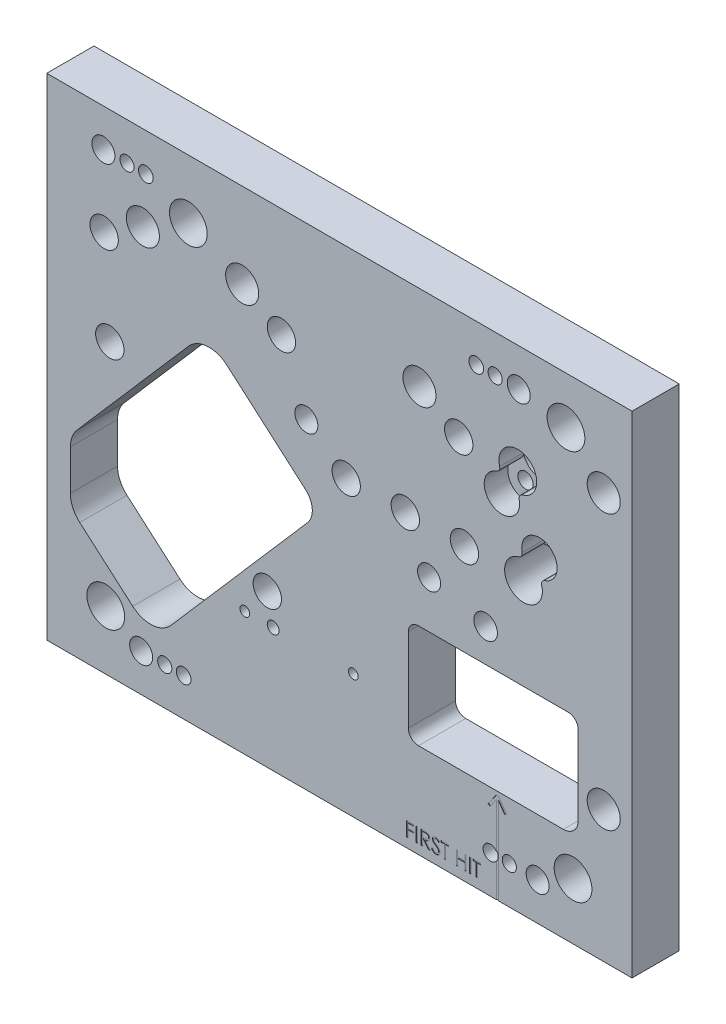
SolidWorks part; units mm, degrees
extrude "Boss-Extrude1" add sketch "Sketch1" along normal blind 31.75 separate body
sketch "Sketch1" plane through (0, 0, 0) normal (0, 0, 1) x (1, 0, 0)
  line L0 (0, 0) -> (-400.0068, 0) construction
  line L1 (-57.15, 149.225) -> (-450.85, 149.225)
  line L2 (-57.15, 149.225) -> (-57.15, -180.975)
  line L3 (-57.15, -180.975) -> (-450.85, -180.975)
  line L4 (-450.85, 149.225) -> (-450.85, -180.975)
  line L6 (0, -304.8) -> (0, 304.8) construction
  line L10 (-101.6, 85.471) -> (-141.351, 85.471) construction
  line L11 (-1219.2, -304.8) -> (0, -304.8) construction
  line L12 (0, 304.8) -> (-1219.2, 304.8) construction
  line L14 (-159.131, -81.407) -> (-149.6352, -81.407) construction
  line L15 (-141.351, -85.471) -> (-141.351, 85.471) construction
  line L16 (0, -304.8) -> (0, 304.8) construction
  line L17 (-101.6, -85.471) -> (-141.351, -85.471) construction
  line L18 (-125.476, -104.521) -> (-149.606, -104.521) construction
  dimension "D1" = 149.225
  dimension "D2" = 330.2
  dimension "D3" = 180.975
  dimension "D4" = 63.754
  dimension "D5" = 99.568
  dimension "D6" = 84.201
  dimension "D7" = 57.15
  dimension "D8" = 393.7
  dimension "D9" = 123.825
  dimension "D10" = 155.575
  dimension "D11" = 57.15
  dimension "D12" = 95.504
  dimension "D13" = 76.454
ref_plane "Front" through (0, 0, 0) normal (0, 0, 1) x (1, 0, 0)
ref_plane "Top" through (0, 0, 0) normal (0, 1, 0) x (1, 0, 0)
ref_plane "Right" through (0, 0, 0) normal (1, 0, 0) x (0, 0, -1)
hole_wizard "Hole1" positions "Point_Sketch" profile "Profil_Sketch" hole size "Ø0.15" standard "ISO"
sketch "Point_Sketch" plane through (-35.4043, 98.1359, 31.75) normal (0, 0, -1) x (1, 0, 0)
  point P0 (-40.7957, 6.0609)
  point P2 (-40.7957, 190.4649)
  point P4 (-164.7477, 6.0609)
  point P6 (-284.0007, 6.0609)
  point P8 (-350.8027, 6.0609)
sketch "Profil_Sketch" plane through (-76.2, 92.075, 31.75) normal (1, 0, 0) x (0, -1, 0)
  line L0 (0, 0) -> (0, 31.75)
  line L1 (0, 31.75) -> (11.1252, 31.75)
  line L2 (11.1252, 31.75) -> (11.1252, 0)
  line L5 (11.1252, 0) -> (0, 0)
  line L11 (0, -6.35) -> (0, 107.95) construction
  dimension "Diameter" = 22.2504
  dimension "Thru Hole Depth" = 31.75
other "usin_DL090<1>"
sketch "Sketch4-P250520R_102_Die Yoke-1 Insert-1" plane through (0, 0, 31.75) normal (0, 0, 1) x (1, 0, 0)
  line L90 (-275.9499, -25.4471) -> (-366.7171, -129.9659) construction
  line L91 (-393.5913, -131.8583) -> (-428.4159, -101.6157) construction
  line L92 (-434.975, -87.2323) -> (-434.975, -60.7311) construction
  line L93 (-355.9919, 37.3355) -> (-430.3083, -48.2402) construction
  line L94 (-277.3377, -5.7393) -> (-329.1177, 39.2279) construction
  line L95 (-275.9499, -25.4471) -> (-366.7171, -129.9659)
  line L96 (-393.5913, -131.8583) -> (-428.4159, -101.6157)
  line L97 (-434.975, -87.2323) -> (-434.975, -60.7311)
  line L98 (-355.9919, 37.3355) -> (-430.3083, -48.2402)
  line L99 (-277.3377, -5.7393) -> (-329.1177, 39.2279)
  arc A82 (-275.9499, -25.4471) -> (-277.3377, -5.7393) centre (-286.4977, -16.2871) ccw construction
  arc A87 (-393.5913, -131.8583) -> (-366.7171, -129.9659) centre (-381.1005, -117.475) ccw construction
  arc A88 (-434.975, -87.2323) -> (-428.4159, -101.6157) centre (-415.925, -87.2323) ccw construction
  arc A99 (-430.3083, -48.2402) -> (-434.975, -60.7311) centre (-415.925, -60.7311) ccw construction
  arc A100 (-329.1177, 39.2279) -> (-355.9919, 37.3355) centre (-341.6086, 24.8446) ccw construction
  arc A101 (-275.9499, -25.4471) -> (-277.3377, -5.7393) centre (-286.4977, -16.2871) ccw
  arc A102 (-393.5913, -131.8583) -> (-366.7171, -129.9659) centre (-381.1005, -117.475) ccw
  arc A103 (-434.975, -87.2323) -> (-428.4159, -101.6157) centre (-415.925, -87.2323) ccw
  arc A104 (-430.3083, -48.2402) -> (-434.975, -60.7311) centre (-415.925, -60.7311) ccw
  arc A111 (-329.1177, 39.2279) -> (-355.9919, 37.3355) centre (-341.6086, 24.8446) ccw
sketch "Sketch5-P250520R_102_Die Yoke-1 Insert-1"
extrude "Cut-Extrude1" cut sketch "Sketch5-P250520R_102_Die Yoke-1 Insert-1" against normal through all
sketch "Sketch6-P250520R_111_Die Insert-1" plane through (0, 0, 31.75) normal (0, 0, 1) x (1, 0, 0)
  line L0 (-93.345, -106.68) -> (-93.345, -55.245)
  line L1 (-200.025, -117.475) -> (-104.14, -117.475)
  line L2 (-207.645, -55.245) -> (-207.645, -109.855)
  line L3 (-100.965, -47.625) -> (-200.025, -47.625)
  line L8 (-159.959, -81.915) -> (-159.959, -85.979)
  line L9 (-149.6352, -81.087) -> (-159.131, -81.087)
  line L10 (-121.8268, -81.087) -> (-137.3848, -81.087)
  line L11 (-118.806, -92.0344) -> (-118.806, -84.1078)
  line L12 (-119.0053, -93.3153) -> (-118.9012, -92.8667)
  line L13 (-119.1006, -98.171) -> (-119.1006, -94.1476)
  line L14 (-149.606, -104.5464) -> (-125.476, -104.5464)
  line L15 (-155.9814, -94.1476) -> (-155.9814, -98.171)
  line L16 (-156.1808, -92.8667) -> (-156.0767, -93.3153)
  line L17 (-156.276, -89.1131) -> (-156.276, -92.0344)
  line L18 (-156.276, -89.1131) -> (-156.276, -92.0344)
  line L19 (-156.1808, -92.8667) -> (-156.0767, -93.3153)
  line L20 (-155.9814, -94.1476) -> (-155.9814, -98.171)
  line L21 (-149.606, -104.5464) -> (-125.476, -104.5464)
  line L22 (-159.959, -81.915) -> (-159.959, -85.979)
  line L30 (-100.965, -47.625) -> (-200.025, -47.625)
  line L31 (-207.645, -55.245) -> (-207.645, -109.855)
  line L32 (-200.025, -117.475) -> (-104.14, -117.475)
  line L33 (-93.345, -106.68) -> (-93.345, -55.245)
  line L36 (-119.1006, -98.171) -> (-119.1006, -94.1476)
  line L37 (-119.0053, -93.3153) -> (-118.9012, -92.8667)
  line L38 (-118.806, -92.0344) -> (-118.806, -84.1078)
  line L39 (-121.8268, -81.087) -> (-137.3848, -81.087)
  line L40 (-149.6352, -81.087) -> (-159.131, -81.087)
  arc A0 (-93.345, -55.245) -> (-100.965, -47.625) centre (-100.965, -55.245) ccw
  arc A1 (-104.14, -117.475) -> (-93.345, -106.68) centre (-104.14, -106.68) ccw
  arc A2 (-207.645, -109.855) -> (-200.025, -117.475) centre (-200.025, -109.855) ccw
  arc A3 (-200.025, -47.625) -> (-207.645, -55.245) centre (-200.025, -55.245) ccw
  circle A8 centre (-187.452, -97.536) radius 3.9687
  circle A9 centre (-171.577, -97.536) radius 3.2639
  circle A10 centre (-183.261, -78.359) radius 9.5377
  arc A11 (-156.276, -89.1131) -> (-158.1175, -87.546) centre (-157.8635, -89.1131) ccw
  arc A12 (-159.131, -81.087) -> (-159.959, -81.915) centre (-159.131, -81.915) ccw
  arc A13 (-149.6352, -81.087) -> (-148.4668, -79.5923) centre (-149.6352, -79.883) ccw
  arc A14 (-111.0107, -53.975) -> (-111.0107, -53.975) centre (-118.745, -53.975) ccw
  arc A15 (-138.5532, -79.5923) -> (-148.4668, -79.5923) centre (-143.51, -78.359) ccw
  arc A18 (-138.5532, -79.5923) -> (-137.3848, -81.087) centre (-137.3848, -79.883) ccw
  arc A20 (-121.8268, -81.087) -> (-121.1613, -80.8863) centre (-121.8268, -79.883) ccw
  arc A21 (-118.6053, -83.4423) -> (-121.1613, -80.8863) centre (-120.142, -82.423) ccw
  arc A32 (-118.6053, -83.4423) -> (-118.806, -84.1078) centre (-117.602, -84.1078) ccw
  arc A33 (-118.9012, -92.8667) -> (-118.806, -92.0344) centre (-122.489, -92.0344) ccw
  arc A34 (-119.0053, -93.3153) -> (-119.1006, -94.1476) centre (-115.4176, -94.1476) ccw
  arc A36 (-125.476, -104.5464) -> (-119.1006, -98.171) centre (-125.476, -98.171) ccw
  arc A37 (-155.9814, -98.171) -> (-149.606, -104.5464) centre (-149.606, -98.171) ccw
  arc A38 (-155.9814, -94.1476) -> (-156.0767, -93.3153) centre (-159.6644, -94.1476) ccw
  arc A39 (-156.276, -92.0344) -> (-156.1808, -92.8667) centre (-152.593, -92.0344) ccw
  arc A42 (-200.025, -47.625) -> (-207.645, -55.245) centre (-200.025, -55.245) ccw
  arc A43 (-207.645, -109.855) -> (-200.025, -117.475) centre (-200.025, -109.855) ccw
  arc A44 (-104.14, -117.475) -> (-93.345, -106.68) centre (-104.14, -106.68) ccw
  arc A45 (-93.345, -55.245) -> (-100.965, -47.625) centre (-100.965, -55.245) ccw
  arc A49 (-156.276, -92.0344) -> (-156.1808, -92.8667) centre (-152.593, -92.0344) ccw
  arc A50 (-155.9814, -94.1476) -> (-156.0767, -93.3153) centre (-159.6644, -94.1476) ccw
  arc A51 (-155.9814, -98.171) -> (-149.606, -104.5464) centre (-149.606, -98.171) ccw
  arc A58 (-125.476, -104.5464) -> (-119.1006, -98.171) centre (-125.476, -98.171) ccw
  arc A61 (-119.0053, -93.3153) -> (-119.1006, -94.1476) centre (-115.4176, -94.1476) ccw
  arc A63 (-118.9012, -92.8667) -> (-118.806, -92.0344) centre (-122.489, -92.0344) ccw
  arc A64 (-118.6053, -83.4423) -> (-118.806, -84.1078) centre (-117.602, -84.1078) ccw
  arc A65 (-118.6053, -83.4423) -> (-121.1613, -80.8863) centre (-120.142, -82.423) ccw
  arc A66 (-121.8268, -81.087) -> (-121.1613, -80.8863) centre (-121.8268, -79.883) ccw
  arc A67 (-159.959, -85.979) -> (-158.1175, -87.546) centre (-158.3715, -85.979) ccw
  arc A68 (-156.276, -89.1131) -> (-158.1175, -87.546) centre (-157.8635, -89.1131) ccw
  circle A82 centre (-183.261, -78.359) radius 9.5377
  circle A83 centre (-171.577, -97.536) radius 3.2639
  circle A84 centre (-187.452, -97.536) radius 3.9687
  arc A85 (-138.5532, -79.5923) -> (-137.3848, -81.087) centre (-137.3848, -79.883) ccw
  arc A86 (-138.5532, -79.5923) -> (-148.4668, -79.5923) centre (-143.51, -78.359) ccw
  arc A87 (-149.6352, -81.087) -> (-148.4668, -79.5923) centre (-149.6352, -79.883) ccw
  arc A88 (-159.131, -81.087) -> (-159.959, -81.915) centre (-159.131, -81.915) ccw
  arc A89 (-159.959, -85.979) -> (-158.1175, -87.546) centre (-158.3715, -85.979) ccw
sketch "Sketch7-P250520R_111_Die Insert-1"
extrude "Cut-Extrude2" cut sketch "Sketch7-P250520R_111_Die Insert-1" against normal through all
hole_wizard "Hole11" positions "Point_Sketch1" profile "Profil_Sketch1" hole size "Ø0.15" standard "ISO"
sketch "Point_Sketch1" plane through (-130.0193, 32.8261, 31.75) normal (0, 0, -1) x (1, 0, 0)
  point P0 (-0.1557, 18.8561)
  point P2 (-3.9657, -43.0691)
sketch "Profil_Sketch1" plane through (-130.175, 13.97, 31.75) normal (1, 0, 0) x (0, -1, 0)
  line L0 (0, 0) -> (0, 31.75)
  line L1 (0, 31.75) -> (12.7, 31.75)
  line L2 (12.7, 31.75) -> (12.7, 0)
  line L5 (12.7, 0) -> (0, 0)
  line L11 (0, -6.35) -> (0, 107.95) construction
  dimension "Diameter" = 25.4
  dimension "Thru Hole Depth" = 31.75
other "usin_DL090<2>"
sketch "FMFT BOLT PATTERN SQUARE" plane through (-166.4623, -109.0835, 0) normal (0, 0, -1) x (-1, 0, 0)
  line L0 (-109.3123, -46.4915) -> (-45.8123, -46.4915) construction
  line L1 (-45.8123, -46.4915) -> (-26.7623, -46.4915) construction
  line L2 (-26.7623, -46.4915) -> (-14.0623, -46.4915) construction
  line L3 (-14.0623, -46.4915) -> (192.3127, -46.4915) construction
  line L4 (192.3127, -46.4915) -> (205.0127, -46.4915) construction
  line L5 (205.0127, -46.4915) -> (220.8877, -46.4915) construction
  line L6 (220.8877, -46.4915) -> (284.3877, -46.4915) construction
  line L7 (246.2877, 258.3085) -> (246.2877, 232.9085) construction
  line L8 (246.2877, 232.9085) -> (246.2877, 217.0335) construction
  line L9 (246.2877, -43.3165) -> (246.2877, -30.6165) construction
  line L10 (246.2877, -30.6165) -> (246.2877, 204.3335) construction
  line L11 (246.2877, -43.3165) -> (246.2877, -59.1915) construction
  line L12 (246.2877, -59.1915) -> (246.2877, -71.8915) construction
  line L13 (284.3877, 232.9085) -> (246.2877, 232.9085) construction
  line L14 (246.2877, 232.9085) -> (230.4127, 232.9085) construction
  line L15 (230.4127, 232.9085) -> (217.7127, 232.9085) construction
  line L16 (217.7127, 232.9085) -> (-4.5373, 232.9085) construction
  line L17 (-4.5373, 232.9085) -> (-17.2373, 232.9085) construction
  line L18 (-17.2373, 232.9085) -> (-33.1123, 232.9085) construction
  line L19 (-33.1123, 232.9085) -> (-109.3123, 232.9085) construction
  line L20 (-45.8123, 258.3085) -> (-45.8123, 232.9085) construction
  line L21 (-45.8123, 232.9085) -> (-45.8123, 213.8585) construction
  line L22 (-45.8123, 213.8585) -> (-45.8123, 201.1585) construction
  line L23 (-45.8123, 201.1585) -> (-45.8123, -14.7415) construction
  line L24 (-45.8123, -14.7415) -> (-45.8123, -27.4415) construction
  line L25 (-45.8123, -27.4415) -> (-45.8123, -46.4915) construction
  line L26 (-45.8123, -46.4915) -> (-45.8123, -71.8915) construction
  line L27 (246.2877, 204.3335) -> (246.2877, 217.0335) construction
  line L28 (-109.3123, -71.8915) -> (284.3877, -71.8915) construction
  line L29 (-109.3123, 258.3085) -> (-109.3123, -71.8915) construction
  line L30 (284.3877, -71.8915) -> (-109.3123, -71.8915) construction
  line L31 (284.3877, 258.3085) -> (-109.3123, 258.3085) construction
  line L32 (284.3877, -71.8915) -> (284.3877, 258.3085) construction
  line L33 (-109.3123, -71.8915) -> (-109.3123, 258.3085) construction
  line L34 (284.3877, 258.3085) -> (284.3877, -71.8915) construction
  circle A0 centre (-26.7623, -46.4915) radius 4.7625 construction
  circle A1 centre (-45.8123, -46.4915) radius 7.1438 construction
  circle A3 centre (-14.0623, -46.4915) radius 5.1594 construction
other "FMFT BOLT PATTERN SQUARE<1>"
hole_wizard "Hole12" positions "Point_Sketch2" profile "Profil_Sketch2" counterbore size "1/4" standard "ANSI Inch"
sketch "Point_Sketch2" plane through (-41.4441, -122.89, 31.75) normal (0, 0, -1) x (1, 0, 0)
  point P0 (-79.2059, 32.685)
  point P2 (-345.9059, 32.685)
  point P4 (-371.3059, -246.715)
  point P6 (-91.9059, -246.715)
  point P8 (-234.7809, -157.815)
  point P10 (-152.2309, -107.015)
sketch "Profil_Sketch2" plane through (-120.65, -155.575, 31.75) normal (1, 0, 0) x (0, -1, 0)
  line L0 (0, 0) -> (0, 31.75)
  line L1 (0, 31.75) -> (5.1562, 31.75)
  line L3 (5.1562, 31.75) -> (5.1562, 17.526)
  line L4 (5.1562, 17.526) -> (7.7343, 17.526)
  line L5 (7.7343, 17.526) -> (7.7343, 0)
  line L7 (7.7343, 0) -> (0, 0)
  line L11 (0, -6.35) -> (0, 107.95) construction
  dimension "Diameter" = 10.3124
  dimension "Thru Hole Depth" = 31.75
  dimension "L1" = 17.526
other "usin_LS160_.375-16x1.75-SHCS<1>"
hole_wizard "Hole13" positions "Point_Sketch3" profile "Profil_Sketch3" hole size "Ø0.15" standard "ISO"
sketch "Point_Sketch3" plane through (-345.5957, 115.3761, 0) normal (0, 0, 1) x (-1, 0, 0)
  point P0 (51.2793, -8.4489)
  point P2 (25.8793, 270.9511)
  point P4 (-205.8957, 270.9511)
  point P6 (-196.3707, -8.4489)
sketch "Profil_Sketch3" plane through (-396.875, 123.825, 0) normal (1, 0, 0) x (0, 1, 0)
  line L0 (0, 0) -> (0, 31.75)
  line L1 (0, 31.75) -> (4.7625, 31.75)
  line L2 (4.7625, 31.75) -> (4.7625, 0)
  line L5 (4.7625, 0) -> (0, 0)
  line L11 (0, -6.35) -> (0, 107.95) construction
  dimension "Diameter" = 9.525
  dimension "Thru Hole Depth" = 31.75
other "usin_DL090_.375 x 2.00 DOWEL PIN<3>"
hole_wizard "Hole14" positions "Point_Sketch4" profile "Profil_Sketch4" tap size "M1.6x0.35" standard "ISO"
sketch "Point_Sketch4" plane through (-338.9669, 114.3807, 31.75) normal (0, 0, -1) x (1, 0, 0)
  point P0 (-45.2081, -9.4443)
  point P2 (-19.8081, 269.9557)
  point P4 (186.5669, 269.9557)
  point P6 (177.0419, -9.4443)
sketch "Profil_Sketch4" plane through (-384.175, 123.825, 31.75) normal (1, 0, 0) x (0, -1, 0)
  line L0 (0, 0) -> (0, 31.75)
  line L1 (0, 31.75) -> (3.9687, 31.75)
  line L2 (3.9687, 31.75) -> (3.9688, 22.6663)
  line L3 (4.953, 0) -> (4.953, 22.098)
  line L4 (4.953, 22.098) -> (3.9688, 22.6663)
  line L5 (4.953, 0) -> (0, 0)
  line L6 (-4.953, 22.098) -> (-3.9688, 22.6663) construction
  line L11 (0, -6.35) -> (0, 107.95) construction
  dimension "Thru Tap Drill Dia." = 7.9375
  dimension "Thru Tap Drill Depth" = 31.75
  dimension "L2" = 22.098
  dimension "A2" = 120
other "usin_TG481<1>"
hole_wizard "Hole16" positions "Point_Sketch6" profile "Profil_Sketch6" hole size "Ø0.15" standard "ISO"
sketch "Point_Sketch6" plane through (-235.7407, -78.4259, 0) normal (0, 0, 1) x (-1, 0, 0)
  point P0 (62.8363, 19.1101)
sketch "Profil_Sketch6" plane through (-298.577, -97.536, 0) normal (1, 0, 0) x (0, 1, 0)
  line L0 (0, 0) -> (0, 31.75)
  line L1 (0, 31.75) -> (3.9687, 31.75)
  line L2 (3.9687, 31.75) -> (3.9687, 0)
  line L5 (3.9687, 0) -> (0, 0)
  line L11 (0, -6.35) -> (0, 107.95) construction
  dimension "Diameter" = 7.9375
  dimension "Thru Hole Depth" = 31.75
other "usin_DL090_.3125 x 1.25 DOWEL PIN<4>"
hole_wizard "Hole110" positions "Point_Sketch10" profile "Profil_Sketch10" counterbore size "1/4" standard "ANSI Inch"
sketch "Point_Sketch10" plane through (-107.7809, 102.535, 0) normal (0, 0, 1) x (-1, 0, 0)
  point P0 (-6.1809, -14.94)
  point P2 (-10.9434, 245.41)
  point P4 (303.3816, 243.8225)
  point P6 (247.8191, -7.0025)
sketch "Profil_Sketch10" plane through (-101.6, 117.475, 0) normal (1, 0, 0) x (0, 1, 0)
  line L0 (0, 0) -> (0, 31.75)
  line L1 (0, 31.75) -> (12.7, 31.75)
  line L3 (12.7, 31.75) -> (12.7, 7.9375)
  line L4 (12.7, 7.9375) -> (16.2719, 7.9375)
  line L5 (16.2719, 7.9375) -> (16.2719, 0)
  line L7 (16.2719, 0) -> (0, 0)
  line L11 (0, -6.35) -> (0, 107.95) construction
  dimension "Diameter" = 25.4
  dimension "Thru Hole Depth" = 31.75
  dimension "L1" = 7.9375
other "usin_LS160<2>"
hole_wizard "Hole111" positions "Point_Sketch11" profile "Profil_Sketch11" hole size "Ø0.15" standard "ISO"
sketch "Point_Sketch11" plane through (-113.5568, -0.8289, 31.75) normal (0, 0, -1) x (1, 0, 0)
  point P0 (-42.0817, 24.5711)
sketch "Profil_Sketch11" plane through (-155.6385, -25.4, 31.75) normal (1, 0, 0) x (0, -1, 0)
  line L0 (0, 0) -> (0, 31.75)
  line L1 (0, 31.75) -> (7.9375, 31.75)
  line L2 (7.9375, 31.75) -> (7.9375, 0)
  line L5 (7.9375, 0) -> (0, 0)
  line L11 (0, -6.35) -> (0, 107.95) construction
  dimension "Diameter" = 15.875
  dimension "Thru Hole Depth" = 31.75
other "usin_DL090<7>"
sketch "Sketch4" plane through (0, 0, 31.75) normal (0, 0, 1) x (1, 0, 0)
  line L0 (-147.701, -117.475) -> (-147.701, -180.975) construction
  line L1 (-200.787, -117.475) -> (-103.378, -117.475) construction
  line L2 (-450.85, -180.975) -> (-57.15, -180.975) construction
  line L3 (-148.463, -122.672) -> (-148.463, -180.975)
  line L4 (-146.939, -122.672) -> (-146.939, -180.975)
  line L5 (-148.463, -120.015) -> (-153.9263, -127.8174)
  line L6 (-153.9263, -127.8174) -> (-152.6779, -128.6916)
  line L7 (-152.6779, -128.6916) -> (-148.463, -122.672)
  line L8 (-142.7241, -128.6916) -> (-146.939, -122.672)
  line L9 (-141.4757, -127.8174) -> (-142.7241, -128.6916)
  line L10 (-146.939, -120.015) -> (-141.4757, -127.8174)
  line L11 (-148.463, -120.015) -> (-146.939, -120.015)
  line L12 (-146.939, -117.475) -> (-146.939, -180.975) construction
  line L13 (-148.463, -117.475) -> (-148.463, -180.975) construction
  line L14 (-148.463, -180.975) -> (-146.939, -180.975)
  line L15 (-209.931, -174.625) -> (-152.781, -174.625) construction
  circle A0 centre (-155.6385, -25.4) radius 7.9375 construction
  text T0 "FIRST HIT" font "Century Gothic" height 9.525
  dimension "D3" = 1.524
  dimension "D4" = 35
  dimension "D5" = 9.525
  dimension "D2" = 2.54
  dimension "D6" = 1.524
  dimension "D7" = 6.35
  dimension "D8" = 5.08
  dimension "D9" = 57.15
  dimension "D1" = 0.762
extrude "Cut-Extrude3" cut sketch "Sketch4" against normal blind 0.254
hole_wizard "Hole112" positions "Point_Sketch12" profile "Profil_Sketch12" counterbore size "1/4" standard "ANSI Inch"
sketch "Point_Sketch12" plane through (-139.2341, 46.9725, 31.75) normal (0, 0, -1) x (1, 0, 0)
  point P0 (19.7747, 14.4425)
  point P2 (-5.4665, -10.3627)
sketch "Profil_Sketch12" plane through (-119.4594, 32.53, 31.75) normal (1, 0, 0) x (0, -1, 0)
  line L0 (0, 0) -> (0, 31.75)
  line L1 (0, 31.75) -> (5.1594, 31.75)
  line L3 (5.1594, 31.75) -> (5.1594, 15.875)
  line L4 (5.1594, 15.875) -> (11.9062, 15.875)
  line L5 (11.9062, 15.875) -> (11.9062, 0)
  line L7 (11.9062, 0) -> (0, 0)
  line L11 (0, -6.35) -> (0, 107.95) construction
  dimension "Diameter" = 10.3187
  dimension "Thru Hole Depth" = 31.75
  dimension "L1" = 15.875
other "usin_LS160<3>"
sketch "Sketch7" [suppressed] plane through (0, 0, 15.875) normal (0, 0, 1) x (1, 0, 0)
  line L0 (-177.165, 22.225) -> (-177.165, 46.0375) construction
  line L1 (-169.2338, 32.144) -> (-169.2338, 37.1574)
  line L2 (-185.0961, 32.144) -> (-185.0961, 37.1574)
  line L3 (-185.0961, 22.225) -> (-185.0961, 46.0375) construction
  line L4 (-169.2338, 22.225) -> (-169.2338, 46.0375) construction
  line L5 (-129.54, 46.7487) -> (-129.54, 70.5612) construction
  line L6 (-121.6088, 55.6288) -> (-121.6088, 60.6422)
  line L7 (-137.4711, 55.6288) -> (-137.4711, 60.6422)
  line L8 (-137.4711, 46.7487) -> (-137.4711, 70.5612) construction
  line L9 (-121.6088, 46.7487) -> (-121.6088, 70.5612) construction
  arc A0 (-174.067, 34.5414) -> (-180.263, 34.5414) centre (-177.165, 46.0375) ccw construction
  arc A1 (-180.263, 34.5414) -> (-174.067, 34.5414) centre (-177.165, 22.225) ccw construction
  arc A2 (-174.067, 34.5414) -> (-169.2338, 37.1574) centre (-177.165, 46.0375) ccw
  arc A3 (-180.263, 34.5414) -> (-185.0961, 32.144) centre (-177.165, 22.225) ccw
  arc A4 (-169.2338, 32.144) -> (-174.067, 34.5414) centre (-177.165, 22.225) ccw
  arc A5 (-185.0961, 37.1574) -> (-180.263, 34.5414) centre (-177.165, 46.0375) ccw
  arc A6 (-126.442, 58.2448) -> (-132.638, 58.2448) centre (-129.54, 70.5612) ccw construction
  arc A7 (-132.638, 58.2448) -> (-126.442, 58.2448) centre (-129.54, 46.7487) ccw construction
  arc A8 (-126.442, 58.2448) -> (-121.6088, 60.6422) centre (-129.54, 70.5612) ccw
  arc A9 (-132.638, 58.2448) -> (-137.4711, 55.6288) centre (-129.54, 46.7487) ccw
  arc A10 (-121.6088, 55.6288) -> (-126.442, 58.2448) centre (-129.54, 46.7487) ccw
  arc A11 (-137.4711, 60.6422) -> (-132.638, 58.2448) centre (-129.54, 70.5612) ccw
extrude "Cut-Extrude4" [suppressed] cut sketch "Sketch7" along normal through all
fillet "Fillet1" [suppressed] radius 3.175
hole_wizard "Hole113" positions "Point_Sketch13" profile "Profil_Sketch13" hole size "Ø0.15" standard "ISO"
sketch "Point_Sketch13" plane through (-170.0817, 86.4963, 0) normal (0, 0, 1) x (-1, 0, 0)
  point P0 (3.6543, 10.6011)
  point P4 (39.5953, 72.5263)
  point P6 (79.3463, 72.5263)
  point P8 (122.9073, 10.6011)
  point P10 (242.1603, 10.6011)
  point P12 (238.3503, 72.5263)
  point P14 (13.1793, 164.8553)
  point P16 (132.4323, 164.8553)
  point P18 (-0.1557, 72.5263)
sketch "Profil_Sketch13" plane through (-173.736, 75.8952, 0) normal (1, 0, 0) x (0, 1, 0)
  line L0 (0, 0) -> (0, 31.75)
  line L1 (0, 31.75) -> (9.5377, 31.75)
  line L2 (9.5377, 31.75) -> (9.5377, 0)
  line L5 (9.5377, 0) -> (0, 0)
  line L11 (0, -6.35) -> (0, 107.95) construction
  dimension "Diameter" = 19.0754
  dimension "Thru Hole Depth" = 31.75
other "usin_DL090<8>"
fillet "Fillet2" radius 3.175 4 edges at (-129.8209, 26.6651, 23.8125) (-119.3578, 20.6242, 23.8125) (-134.3391, 63.2001, 23.8125) (-144.8022, 69.241, 23.8125)
hole_wizard "Hole114" positions "Point_Sketch14" profile "Profil_Sketch14" tap size "5/16-18" standard "ANSI Inch"
sketch "Point_Sketch14" plane through (-320.0439, -87.9303, 31.75) normal (0, 0, -1) x (-1, 0, 0)
  point P0 (-2.4169, -9.6057)
  point P2 (-75.4419, -9.6057)
sketch "Profil_Sketch14" plane through (-317.627, -97.536, 31.75) normal (1, 0, 0) x (0, -1, 0)
  line L0 (0, 0) -> (0, 31.75)
  line L1 (0, 31.75) -> (3.2639, 31.75)
  line L2 (3.2639, 31.75) -> (3.2639, 0)
  line L5 (3.2639, 0) -> (0, 0)
  line L11 (0, -6.35) -> (0, 107.95) construction
  dimension "Thru Tap Drill Dia." = 6.5278
  dimension "Thru Tap Drill Depth" = 31.75
other "usin_TS230_.3125-18x.75-SHCS<1>"
sketch "Sketch1 _Machining axis" plane through (0, 0, 31.75) normal (0, 0, 1) x (1, 0, 0)
  line L0 (-367.2168, -130.5412) -> (-275.4503, -24.8717) construction
  line L1 (-282.6168, -25.3764) -> (-271.2309, -35.2642) construction
  line L2 (-267.9, -31.4286) -> (-275.4503, -24.8717) construction
  line L3 (-207.645, -54.483) -> (-207.645, -110.617) construction
  point P0 (-282.6168, -25.3764)
  point P7 (-202.565, -59.563)
sketch "Sketch1 _Wire EDM" plane through (0, 0, 31.75) normal (0, 0, 1) x (1, 0, 0)
  circle A0 centre (-282.6168, -25.3764) radius 3.175
  circle A1 centre (-202.565, -59.563) radius 3.175
equation "\"+.02r_DR\"=\"0.020000\""
equation "\"-.03r_DR\"=\"-0.030000\""
equation "\"D3@Sketch7-P250520R_111_Die Insert-1\"= \"D2@Sketch7-P250520R_111_Die Insert-1\" + \"-.03r_DR\""
equation "\"D5@Sketch7-P250520R_111_Die Insert-1\"= \"D4@Sketch7-P250520R_111_Die Insert-1\" + \"-.03r_DR\""
equation "\"D7@Sketch7-P250520R_111_Die Insert-1\"= \"D6@Sketch7-P250520R_111_Die Insert-1\" + \"-.03r_DR\""
equation "\"D9@Sketch7-P250520R_111_Die Insert-1\"= \"D8@Sketch7-P250520R_111_Die Insert-1\" + \"-.03r_DR\""
equation "\"D2@FMFT BOLT PATTERN SQUARE\"=1.5 * \"D1@FMFT BOLT PATTERN SQUARE\""
equation "\"D4@FMFT BOLT PATTERN SQUARE\"= \"D1@FMFT BOLT PATTERN SQUARE\" + .03125"
equation "\"D5@FMFT BOLT PATTERN SQUARE\"= 2 * \"D1@FMFT BOLT PATTERN SQUARE\""
equation "\"D7@FMFT BOLT PATTERN SQUARE\"= \"D1@FMFT BOLT PATTERN SQUARE\" + .125"
equation "\"D3@FMFT BOLT PATTERN SQUARE\"=2 * \"D1@FMFT BOLT PATTERN SQUARE\"+.25"
equation "\"D8@FMFT BOLT PATTERN SQUARE\"=2 * \"D1@FMFT BOLT PATTERN SQUARE\"+.25"
equation "\"D12@FMFT BOLT PATTERN SQUARE\"=2 * \"D1@FMFT BOLT PATTERN SQUARE\"-.25"
equation "\"D5@Sketch5-P250520R_102_Die Yoke-1 Insert-1\"= \"D3@Sketch5-P250520R_102_Die Yoke-1 Insert-1\" + \"-.03r_DR\""
equation "\"D9@Sketch5-P250520R_102_Die Yoke-1 Insert-1\"= \"D7@Sketch5-P250520R_102_Die Yoke-1 Insert-1\" + \"-.03r_DR\""
equation "\"D11@Sketch5-P250520R_102_Die Yoke-1 Insert-1\"= \"D10@Sketch5-P250520R_102_Die Yoke-1 Insert-1\" + \"-.03r_DR\""
equation "\"D13@Sketch5-P250520R_102_Die Yoke-1 Insert-1\"= \"D12@Sketch5-P250520R_102_Die Yoke-1 Insert-1\" + \"-.03r_DR\""
equation "\"D15@Sketch5-P250520R_102_Die Yoke-1 Insert-1\"= \"D14@Sketch5-P250520R_102_Die Yoke-1 Insert-1\" + \"-.03r_DR\""
